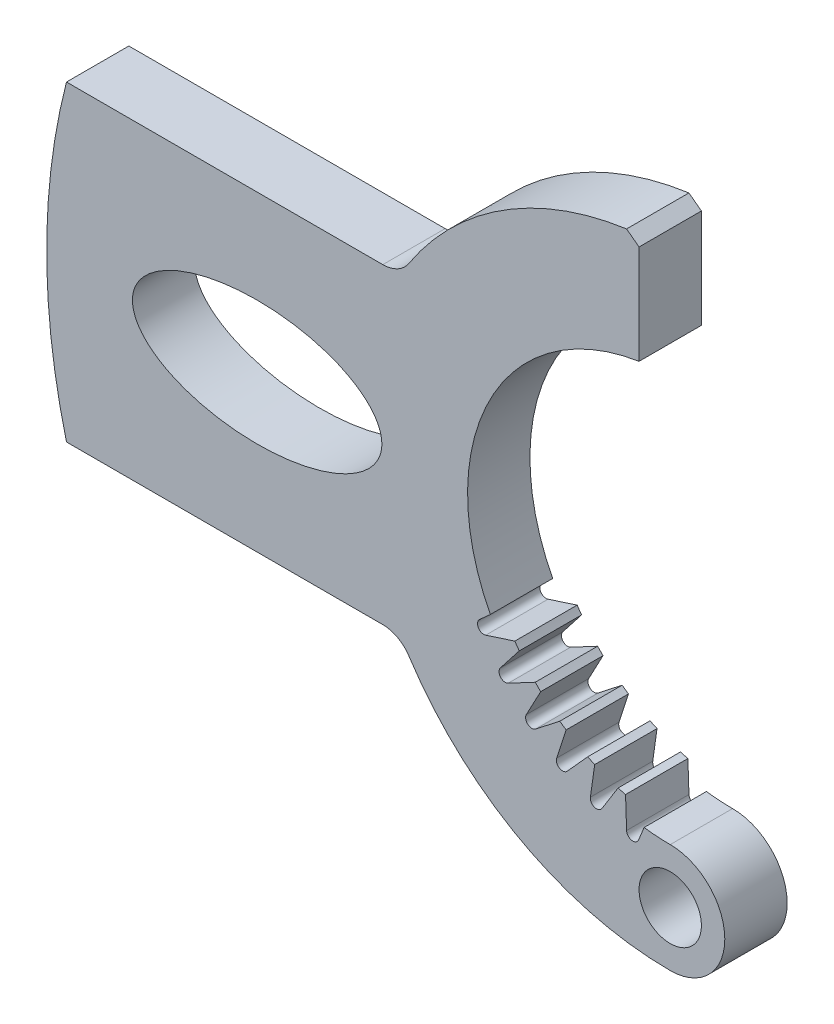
SolidWorks part; units mm, degrees
ref_plane "Plan de face" through (0, 0, 0) normal (0, 0, 1) x (1, 0, 0)
ref_plane "Plan de dessus" through (0, 0, 0) normal (0, 1, 0) x (1, 0, 0)
ref_plane "Plan de droite" through (0, 0, 0) normal (1, 0, 0) x (0, 0, -1)
sketch "Esquisse1" plane through (0, 0, 0) normal (0, 0, 1) x (1, 0, 0)
  line L0 (96.8246, 93.0105) -> (96.8246, 25) construction
  line L1 (0, 0) -> (50.7269, 0)
  line L3 (0, 50) -> (50.7269, 50)
  line L5 (96.8246, 25) -> (96.8246, -42.4444) construction
  line L6 (91.8246, 73) -> (91.8246, 57.1131)
  line L7 (89.8246, 74.5076) -> (91.8246, 73)
  line L8 (67.9765, 10.0321) -> (66.2492, 8.4768)
  line L9 (96.8246, 25) -> (55.7591, 25) construction
  line L10 (67.2273, 6.7826) -> (71.9016, 8.3013)
  line L11 (96.8246, 25) -> (39.0753, -8.3416) construction
  line L12 (72.6088, 7.2914) -> (69.5829, 3.4184)
  line L13 (70.8404, 1.9198) -> (75.18, 4.2272)
  line L14 (96.8246, 25) -> (70.3709, 2.8028) construction
  line L15 (76.0518, 3.3554) -> (73.7444, -0.9842)
  line L16 (75.243, -2.2417) -> (79.1159, 0.7842)
  line L17 (80.1259, 0.077) -> (78.6071, -4.5973)
  line L18 (83.59, -1.923) -> (80.3013, -5.5754)
  line L19 (96.8246, 25) -> (72.6643, -16.8469) construction
  line L20 (84.7074, -2.444) -> (84.0234, -7.311)
  line L21 (96.8246, 25) -> (85.0137, -7.4502) construction
  line L22 (85.8617, -7.9801) -> (88.4662, -3.8121)
  line L23 (89.6571, -4.1312) -> (89.8286, -9.0431)
  line L24 (96.8246, 25) -> (90.828, -9.0082) construction
  line L25 (96.8246, 25) -> (74.6273, -1.4536) construction
  line L26 (91.7552, -9.3828) -> (92.6259, -7.2276)
  arc A0 (0, 50) -> (0, 0) centre (96.8246, 25) ccw
  arc A1 (89.8246, 74.5076) -> (54.9176, 52.2727) centre (96.8246, 25) ccw
  arc A2 (91.8246, 57.1131) -> (67.9765, 10.0321) centre (96.8246, 25) ccw
  arc A3 (54.9176, -2.2727) -> (96.8246, -25) centre (96.8246, 25) ccw
  arc A4 (96.8246, -7.5) -> (96.8246, -25) centre (96.8246, -16.25) cw
  circle A5 centre (96.8246, -16.25) radius 5
  arc A7 (66.2492, 8.4768) -> (67.2273, 6.7826) centre (66.9183, 7.7336) ccw
  arc A9 (69.5829, 3.4184) -> (70.8404, 1.9198) centre (70.3709, 2.8028) ccw
  arc A11 (84.0234, -7.311) -> (85.8617, -7.9801) centre (85.0137, -7.4502) ccw
  arc A12 (73.7444, -0.9842) -> (75.243, -2.2417) centre (74.6273, -1.4536) ccw
  arc A13 (78.6071, -4.5973) -> (80.3013, -5.5754) centre (79.5582, -4.9063) ccw
  arc A16 (92.6259, -7.2276) -> (96.8246, -7.5) centre (96.8246, 25) ccw
  arc A17 (89.8286, -9.0431) -> (91.7552, -9.3828) centre (90.828, -9.0082) ccw
  arc A18 (88.4662, -3.8121) -> (89.6571, -4.1312) centre (96.8246, 25) ccw
  arc A19 (83.59, -1.923) -> (84.7074, -2.444) centre (96.8246, 25) ccw
  arc A20 (79.1159, 0.7842) -> (80.1259, 0.077) centre (96.8246, 25) ccw
  arc A21 (71.9016, 8.3013) -> (72.6088, 7.2914) centre (96.8246, 25) ccw
  arc A22 (50.7269, 0) -> (54.9176, -2.2727) centre (50.7269, -5) cw
  arc A23 (50.7269, 50) -> (54.9176, 52.2727) centre (50.7269, 55) ccw
  arc A24 (75.18, 4.2272) -> (76.0518, 3.3554) centre (96.8246, 25) ccw
  ellipse E0 centre (30.5746, 25) end of major axis (50.5746, 25) minor radius 10
  point P55 (53.5233, 0)
  dimension "D5" = 100
  dimension "D7" = 1
  dimension "D8" = 65
  dimension "D12" = 10
  dimension "D13" = 30
  dimension "D14" = 1
  dimension "D15" = 24
  dimension "D16" = 10
  dimension "D18" = 1
  dimension "D23" = 5
  dimension "D29" = 12
  dimension "D30" = 1
  dimension "D34" = 1
  dimension "D38" = 30
  dimension "D1" = 50
  dimension "D2" = 20
  dimension "D3" = 40
  dimension "D4" = 25
  dimension "D6" = 66.25
  dimension "D9" = 10
  dimension "D10" = 2
  dimension "D11" = 48
  dimension "D17" = 24
  dimension "D19" = 10
  dimension "D20" = 4
  dimension "D21" = 96.8246
  dimension "D22" = 2
  dimension "D24" = 10
  dimension "D25" = 24
  dimension "D26" = 12
  dimension "D27" = 4
  dimension "D28" = 41.25
  dimension "D31" = 10
  dimension "D32" = 24
  dimension "D33" = 12
  dimension "D35" = 24
  dimension "D36" = 10
  dimension "D37" = 12
extrude "Boss.-Extru.1" add sketch "Esquisse1" along normal blind 10
